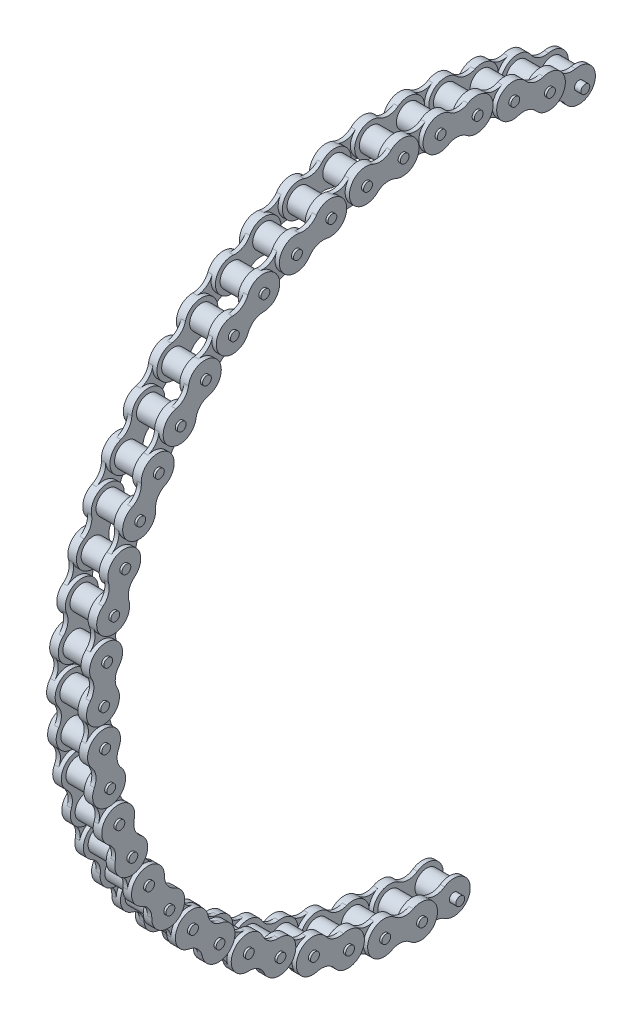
SolidWorks part; units mm, degrees
ref_plane "Plan de face" through (0, 0, 0) normal (0, 0, 1) x (1, 0, 0)
ref_plane "Plan de dessus" through (0, 0, 0) normal (0, 1, 0) x (1, 0, 0)
ref_plane "Plan de droite" through (0, 0, 0) normal (1, 0, 0) x (0, 0, -1)
ref_plane "Plan1" through (5.55, 0, 0) normal (1, 0, 0) x (0, 0, -1)
sketch "Esquisse2" plane through (5.55, 0, 0) normal (1, 0, 0) x (0, 0, -1)
  line L0 (0, 0) -> (77.6529, 191.1858) construction
  line L1 (0, 0) -> (30.7207, 184.099) construction
  line L2 (0, 0) -> (-50.7866, 179.6021) construction
  line L3 (0, 0) -> (0, -186.6446) construction
  line L4 (0, 0) -> (-40.8156, -182.1271) construction
  line L5 (0, 0) -> (-79.6555, -168.7934) construction
  line L6 (0, 0) -> (-183.1826, 35.7818) construction
  line L7 (0, 0) -> (-170.9242, 74.9743) construction
  line L8 (0, 0) -> (-150.3917, 110.5375) construction
  line L9 (0, 0) -> (-122.5792, 140.7499) construction
  line L10 (0, 0) -> (-88.833, 164.149) construction
  line L11 (0, 0) -> (-186.5737, -5.1429) construction
  line L12 (0, 0) -> (-180.9333, -45.8185) construction
  line L13 (0, 0) -> (-166.5344, -84.2763) construction
  line L14 (0, 0) -> (-144.0741, -118.6544) construction
  line L15 (0, 0) -> (-114.6395, -147.2888) construction
  line L16 (0, 0) -> (73.7864, 156.3714) construction
  line L17 (0, 0) -> (56.1365, 163.5395) construction
  line L18 (0, 0) -> (-10.2818, 186.3612) construction
  line L19 (0, 0) -> (40.8156, -182.1271) construction
  line L20 (0, 0) -> (79.6554, -168.7934) construction
  line L21 (0, 0) -> (114.6394, -147.2889) construction
  line L22 (0, 0) -> (144.0739, -118.6546) construction
  line L23 (0, 0) -> (166.5343, -84.2765) construction
  line L24 (0, 0) -> (180.9333, -45.8189) construction
  line L25 (0, 0) -> (186.5737, -5.1432) construction
  line L26 (0, 0) -> (183.1827, 35.7813) construction
  line L27 (0, 0) -> (170.9243, 74.9738) construction
  line L28 (0, 0) -> (150.392, 110.5371) construction
  line L29 (0, 0) -> (122.5797, 140.7495) construction
  line L30 (0, 0) -> (88.8336, 164.1487) construction
  line L31 (0, 0) -> (50.7873, 179.6019) construction
  line L32 (0, 0) -> (10.2826, 186.3611) construction
  line L33 (0, 0) -> (-30.7199, 184.0992) construction
  line L34 (0, 0) -> (-70.2353, 172.9254) construction
  circle A0 centre (0, 0) radius 172.9059 construction
  arc A1 (66.7417, 151.6744) -> (72.0121, 164.6504) centre (73.7864, 156.3714) ccw
  arc A2 (57.9227, 155.2563) -> (63.1932, 168.2324) centre (56.1485, 163.5353) cw
  arc A3 (66.7417, 151.6744) -> (57.9227, 155.2563) centre (59.697, 146.9773) ccw
  arc A4 (63.1932, 168.2324) -> (72.0121, 164.6504) centre (70.2379, 172.9294) ccw
  arc A5 (31.9581, 162.5984) -> (34.2633, 176.413) centre (37.8051, 168.7224) ccw
  arc A6 (31.9581, 162.5984) -> (22.5692, 164.1652) centre (26.111, 156.4745) ccw
  arc A7 (22.5692, 164.1652) -> (24.8745, 177.9797) centre (19.0274, 171.8558) cw
  arc A8 (24.8745, 177.9797) -> (34.2633, 176.413) centre (30.7215, 184.1036) ccw
  arc A9 (-4.3726, 165.6516) -> (-5.1441, 179.6359) centre (-0.0063, 172.9059) ccw
  arc A10 (-4.3726, 165.6516) -> (-13.8768, 165.1272) centre (-8.7389, 158.3973) ccw
  arc A11 (-13.8768, 165.1272) -> (-14.6483, 179.1115) centre (-19.0147, 171.8572) cw
  arc A12 (-14.6483, 179.1115) -> (-5.1441, 179.6359) centre (-10.282, 186.3659) ccw
  arc A13 (-40.4916, 160.686) -> (-44.3025, 174.1631) centre (-37.8173, 168.7196) ccw
  arc A14 (-40.4916, 160.686) -> (-49.6511, 158.096) centre (-43.1659, 152.6525) ccw
  arc A15 (-49.6511, 158.096) -> (-53.462, 171.5731) centre (-56.1363, 163.5395) cw
  arc A16 (-53.462, 171.5731) -> (-44.3025, 174.1631) centre (-50.7878, 179.6067) ccw
  arc A17 (-74.6505, 147.9421) -> (-81.3164, 160.2597) centre (-73.7977, 156.3661) ccw
  arc A18 (-74.6505, 147.9421) -> (-83.0219, 143.4118) centre (-75.5033, 139.5182) ccw
  arc A19 (-83.0219, 143.4118) -> (-89.6878, 155.7293) centre (-90.5406, 147.3053) cw
  arc A20 (-89.6878, 155.7293) -> (-81.3164, 160.2597) centre (-88.835, 164.1532) ccw
  arc A21 (-105.1958, 128.0368) -> (-114.394, 138.5985) centre (-106.2058, 136.4433) ccw
  arc A22 (-105.1958, 128.0368) -> (-112.3739, 121.7854) centre (-104.1858, 119.6302) ccw
  arc A23 (-112.3739, 121.7854) -> (-121.572, 132.3471) centre (-120.562, 123.9405) cw
  arc A24 (-121.572, 132.3471) -> (-114.394, 138.5985) centre (-122.5821, 140.7536) ccw
  arc A25 (-130.6489, 101.9335) -> (-141.934, 110.2281) centre (-133.4728, 109.9157) ccw
  arc A26 (-130.6489, 101.9335) -> (-136.2862, 94.2637) centre (-127.8249, 93.9513) ccw
  arc A27 (-136.2862, 94.2637) -> (-147.5713, 102.5583) centre (-144.7474, 94.5761) cw
  arc A28 (-147.5713, 102.5583) -> (-141.934, 110.2281) centre (-150.3953, 110.5405) ccw
  arc A29 (-149.7776, 70.896) -> (-162.6035, 76.522) centre (-154.2788, 78.0674) ccw
  arc A30 (-149.7776, 70.896) -> (-153.6012, 62.1791) centre (-145.2765, 63.7245) ccw
  arc A31 (-153.6012, 62.1791) -> (-166.4271, 67.805) centre (-161.926, 60.6336) cw
  arc A32 (-166.4271, 67.805) -> (-162.6035, 76.522) centre (-170.9283, 74.9765) ccw
  arc A33 (-161.6561, 36.4266) -> (-175.4018, 39.1116) centre (-167.6165, 42.4401) ccw
  arc A34 (-161.6561, 36.4266) -> (-163.4809, 27.0845) centre (-155.6956, 30.413) ccw
  arc A35 (-163.4809, 27.0845) -> (-177.2267, 29.7695) centre (-171.2662, 23.7559) cw
  arc A36 (-177.2267, 29.7695) -> (-175.4018, 39.1116) centre (-183.1871, 35.7831) ccw
  arc A37 (-165.7092, 0.1938) -> (-179.7094, -0.1921) centre (-172.8404, 4.7584) ccw
  arc A38 (-165.7092, 0.1938) -> (-165.4469, -9.3212) centre (-158.5779, -4.3708) ccw
  arc A39 (-165.4469, -9.3212) -> (-179.4472, -9.7071) centre (-172.3159, -14.2717) cw
  arc A40 (-179.4472, -9.7071) -> (-179.7094, -0.1921) centre (-186.5784, -5.1425) ccw
  arc A41 (-161.7408, -36.0483) -> (-175.3178, -39.4864) centre (-169.6977, -33.1537) ccw
  arc A42 (-161.7408, -36.0483) -> (-159.4042, -45.2757) centre (-153.784, -38.9429) ccw
  arc A43 (-159.4042, -45.2757) -> (-172.9812, -48.7138) centre (-165.0243, -51.6084) cw
  arc A44 (-172.9812, -48.7138) -> (-175.3178, -39.4864) centre (-180.938, -45.8192) ccw
  arc A45 (-149.943, -70.5454) -> (-162.4396, -76.8693) centre (-158.3403, -69.4608) ccw
  arc A46 (-149.943, -70.5454) -> (-145.6451, -79.0385) centre (-141.5458, -71.63) ccw
  arc A47 (-145.6451, -79.0385) -> (-158.1416, -85.3624) centre (-149.7444, -86.447) cw
  arc A48 (-158.1416, -85.3624) -> (-162.4396, -76.8693) centre (-166.5389, -84.2778) ccw
  arc A49 (-130.887, -101.6276) -> (-141.6981, -110.5312) centre (-139.3181, -102.4056) ccw
  arc A50 (-130.887, -101.6276) -> (-124.8358, -108.9753) centre (-122.4558, -100.8496) ccw
  arc A51 (-124.8358, -108.9753) -> (-135.6469, -117.8789) centre (-127.2157, -117.1009) cw
  arc A52 (-135.6469, -117.8789) -> (-141.6981, -110.5312) centre (-144.0781, -118.6569) ccw
  arc A53 (-105.495, -127.7903) -> (-114.0975, -138.8427) centre (-113.552, -130.3932) ccw
  arc A54 (-105.495, -127.7903) -> (-97.9835, -133.6369) centre (-97.438, -125.1874) ccw
  arc A55 (-97.9835, -133.6369) -> (-106.5859, -144.6892) centre (-98.5289, -142.0863) cw
  arc A56 (-106.5859, -144.6892) -> (-114.0975, -138.8427) centre (-114.6429, -147.2921) ccw
  arc A57 (-74.9964, -147.7671) -> (-80.9737, -160.4331) centre (-82.2891, -152.0689) ccw
  arc A58 (-74.9964, -147.7671) -> (-66.3881, -151.8295) centre (-67.7036, -143.4653) ccw
  arc A59 (-66.3881, -151.8295) -> (-72.3654, -164.4955) centre (-65.0726, -160.1937) cw
  arc A60 (-72.3654, -164.4955) -> (-80.9737, -160.4331) centre (-79.6582, -168.7973) ccw
  arc A61 (-40.8674, -160.5909) -> (-43.9302, -174.2574) centre (-47.0429, -166.3834) ccw
  arc A62 (-40.8674, -160.5909) -> (-31.5791, -162.6725) centre (-34.6918, -154.7984) ccw
  arc A63 (-31.5791, -162.6725) -> (-34.6419, -176.339) centre (-28.4664, -170.5465) cw
  arc A64 (-34.6419, -176.339) -> (-43.9302, -174.2574) centre (-40.8175, -182.1315) ccw
  arc A65 (-4.7601, -165.6409) -> (-4.7602, -179.6465) centre (-9.5194, -172.6437) ccw
  arc A66 (-4.7601, -165.6409) -> (4.7586, -165.641) centre (-0.0007, -158.6382) ccw
  arc A67 (4.7586, -165.641) -> (4.7585, -179.6465) centre (9.5179, -172.6438) cw
  arc A68 (4.7585, -179.6465) -> (-4.7602, -179.6465) centre (-0.0009, -186.6493) ccw
  dimension "D1" = 17
extrude "Boss.-Extru.5" add sketch "Esquisse2" along normal blind 2.202
sketch "Esquisse4" plane through (7.752, 0, 0) normal (1, 0, 0) x (0, 0, -1)
  line L0 (0, 0) -> (0, -186.6493) construction
  line L1 (0, 0) -> (70.2379, 172.9294) construction
  line L2 (0, 0) -> (40.8166, -182.1317) construction
  line L3 (0, 0) -> (79.6574, -168.7977) construction
  line L4 (0, 0) -> (114.6422, -147.2926) construction
  line L5 (0, 0) -> (144.0775, -118.6575) construction
  line L6 (0, 0) -> (166.5385, -84.2786) construction
  line L7 (0, 0) -> (180.9378, -45.82) construction
  line L8 (0, 0) -> (186.5784, -5.1434) construction
  line L9 (0, 0) -> (183.1873, 35.7822) construction
  line L10 (0, 0) -> (170.9286, 74.9757) construction
  line L11 (0, 0) -> (150.3958, 110.5398) construction
  line L12 (0, 0) -> (122.5827, 140.7531) construction
  line L13 (0, 0) -> (88.8358, 164.1528) construction
  line L14 (0, 0) -> (50.7886, 179.6064) construction
  line L15 (0, 0) -> (10.2828, 186.3658) construction
  line L16 (0, 0) -> (-30.7207, 184.1038) construction
  line L17 (0, 0) -> (-70.2371, 172.9298) construction
  circle A0 centre (73.7864, 156.3714) radius 6.05
  circle A1 centre (56.1485, 163.5353) radius 6.05
  circle A2 centre (37.8051, 168.7224) radius 6.05
  circle A3 centre (19.0274, 171.8558) radius 6.05
  circle A4 centre (-0.0063, 172.9059) radius 6.05
  circle A5 centre (-19.0147, 171.8572) radius 6.05
  circle A6 centre (-37.8173, 168.7196) radius 6.05
  circle A7 centre (-56.1363, 163.5395) radius 6.05
  circle A8 centre (-73.7977, 156.3661) radius 6.05
  circle A9 centre (-90.5406, 147.3053) radius 6.05
  circle A10 centre (-106.2058, 136.4433) radius 6.05
  circle A11 centre (-120.562, 123.9405) radius 6.05
  circle A12 centre (-133.4728, 109.9157) radius 6.05
  circle A13 centre (-144.7474, 94.5761) radius 6.05
  circle A14 centre (-154.2788, 78.0674) radius 6.05
  circle A15 centre (-161.926, 60.6336) radius 6.05
  circle A16 centre (-167.6165, 42.4401) radius 6.05
  circle A17 centre (-171.2662, 23.7559) radius 6.05
  circle A18 centre (-172.8404, 4.7584) radius 6.05
  circle A19 centre (-172.3159, -14.2717) radius 6.05
  circle A20 centre (-169.6977, -33.1537) radius 6.05
  circle A21 centre (-165.0243, -51.6084) radius 6.05
  circle A22 centre (-158.3403, -69.4608) radius 6.05
  circle A23 centre (-149.7444, -86.447) radius 6.05
  circle A24 centre (-139.3181, -102.4056) radius 6.05
  circle A25 centre (-127.2157, -117.1009) radius 6.05
  circle A26 centre (-113.552, -130.3932) radius 6.05
  circle A27 centre (-98.5289, -142.0863) radius 6.05
  circle A28 centre (-82.2891, -152.0689) radius 6.05
  circle A29 centre (-65.0726, -160.1937) radius 6.05
  circle A30 centre (-47.0429, -166.3834) radius 6.05
  circle A31 centre (-28.4664, -170.5465) radius 6.05
  circle A32 centre (-9.5194, -172.6437) radius 6.05
  circle A33 centre (9.5179, -172.6438) radius 6.05
  arc A34 (4.7585, -179.6465) -> (4.7586, -165.641) centre (9.5179, -172.6438) ccw construction
  dimension "D1" = 17
extrude "Boss.-Extru.6" add sketch "Esquisse4" along normal blind 11.7
sketch "Esquisse5" plane through (19.452, 0, 0) normal (1, 0, 0) x (0, 0, -1)
  arc A0 (66.7417, 151.6744) -> (72.0121, 164.6504) centre (73.7864, 156.3714) ccw
  arc A1 (63.1932, 168.2324) -> (57.9227, 155.2563) centre (56.1485, 163.5353) ccw
  arc A2 (63.1932, 168.2324) -> (72.0121, 164.6504) centre (70.2379, 172.9294) ccw
  arc A3 (66.7417, 151.6744) -> (57.9227, 155.2563) centre (59.697, 146.9773) ccw
  arc A4 (31.9581, 162.5984) -> (34.2633, 176.413) centre (37.8051, 168.7224) ccw
  arc A5 (24.8745, 177.9797) -> (34.2633, 176.413) centre (30.7215, 184.1036) ccw
  arc A6 (31.9581, 162.5984) -> (22.5692, 164.1652) centre (26.111, 156.4745) ccw
  arc A7 (24.8745, 177.9797) -> (22.5692, 164.1652) centre (19.0274, 171.8558) ccw
  arc A8 (-4.3726, 165.6516) -> (-5.1441, 179.6359) centre (-0.0063, 172.9059) ccw
  arc A9 (-14.6483, 179.1115) -> (-5.1441, 179.6359) centre (-10.282, 186.3659) ccw
  arc A10 (-4.3726, 165.6516) -> (-13.8768, 165.1272) centre (-8.7389, 158.3973) ccw
  arc A11 (-14.6483, 179.1115) -> (-13.8768, 165.1272) centre (-19.0147, 171.8572) ccw
  arc A12 (-40.4916, 160.686) -> (-44.3025, 174.1631) centre (-37.8173, 168.7196) ccw
  arc A13 (-53.462, 171.5731) -> (-44.3025, 174.1631) centre (-50.7878, 179.6067) ccw
  arc A14 (-40.4916, 160.686) -> (-49.6511, 158.096) centre (-43.1659, 152.6525) ccw
  arc A15 (-53.462, 171.5731) -> (-49.6511, 158.096) centre (-56.1363, 163.5395) ccw
  arc A16 (-74.6505, 147.9421) -> (-81.3164, 160.2597) centre (-73.7977, 156.3661) ccw
  arc A17 (-89.6878, 155.7293) -> (-81.3164, 160.2597) centre (-88.835, 164.1532) ccw
  arc A18 (-74.6505, 147.9421) -> (-83.0219, 143.4118) centre (-75.5033, 139.5182) ccw
  arc A19 (-89.6878, 155.7293) -> (-83.0219, 143.4118) centre (-90.5406, 147.3053) ccw
  arc A20 (-105.1958, 128.0368) -> (-114.394, 138.5985) centre (-106.2058, 136.4433) ccw
  arc A21 (-121.572, 132.3471) -> (-114.394, 138.5985) centre (-122.5821, 140.7536) ccw
  arc A22 (-105.1958, 128.0368) -> (-112.3739, 121.7854) centre (-104.1858, 119.6302) ccw
  arc A23 (-121.572, 132.3471) -> (-112.3739, 121.7854) centre (-120.562, 123.9405) ccw
  arc A24 (-130.6489, 101.9335) -> (-141.934, 110.2281) centre (-133.4728, 109.9157) ccw
  arc A25 (-147.5713, 102.5583) -> (-141.934, 110.2281) centre (-150.3953, 110.5405) ccw
  arc A26 (-130.6489, 101.9335) -> (-136.2862, 94.2637) centre (-127.8249, 93.9513) ccw
  arc A27 (-147.5713, 102.5583) -> (-136.2862, 94.2637) centre (-144.7474, 94.5761) ccw
  arc A28 (-149.7776, 70.896) -> (-162.6035, 76.522) centre (-154.2788, 78.0674) ccw
  arc A29 (-166.4271, 67.805) -> (-162.6035, 76.522) centre (-170.9283, 74.9765) ccw
  arc A30 (-149.7776, 70.896) -> (-153.6012, 62.1791) centre (-145.2765, 63.7245) ccw
  arc A31 (-166.4271, 67.805) -> (-153.6012, 62.1791) centre (-161.926, 60.6336) ccw
  arc A32 (-161.6561, 36.4266) -> (-175.4018, 39.1116) centre (-167.6165, 42.4401) ccw
  arc A33 (-177.2267, 29.7695) -> (-175.4018, 39.1116) centre (-183.1871, 35.7831) ccw
  arc A34 (-161.6561, 36.4266) -> (-163.4809, 27.0845) centre (-155.6956, 30.413) ccw
  arc A35 (-177.2267, 29.7695) -> (-163.4809, 27.0845) centre (-171.2662, 23.7559) ccw
  arc A36 (-165.7092, 0.1938) -> (-179.7094, -0.1921) centre (-172.8404, 4.7584) ccw
  arc A37 (-179.4472, -9.7071) -> (-179.7094, -0.1921) centre (-186.5784, -5.1425) ccw
  arc A38 (-165.7092, 0.1938) -> (-165.4469, -9.3212) centre (-158.5779, -4.3708) ccw
  arc A39 (-179.4472, -9.7071) -> (-165.4469, -9.3212) centre (-172.3159, -14.2717) ccw
  arc A40 (-161.7408, -36.0483) -> (-175.3178, -39.4864) centre (-169.6977, -33.1537) ccw
  arc A41 (-172.9812, -48.7138) -> (-175.3178, -39.4864) centre (-180.938, -45.8192) ccw
  arc A42 (-161.7408, -36.0483) -> (-159.4042, -45.2757) centre (-153.784, -38.9429) ccw
  arc A43 (-172.9812, -48.7138) -> (-159.4042, -45.2757) centre (-165.0243, -51.6084) ccw
  arc A44 (-149.943, -70.5454) -> (-162.4396, -76.8693) centre (-158.3403, -69.4608) ccw
  arc A45 (-158.1416, -85.3624) -> (-162.4396, -76.8693) centre (-166.5389, -84.2778) ccw
  arc A46 (-149.943, -70.5454) -> (-145.6451, -79.0385) centre (-141.5458, -71.63) ccw
  arc A47 (-158.1416, -85.3624) -> (-145.6451, -79.0385) centre (-149.7444, -86.447) ccw
  arc A48 (-130.887, -101.6276) -> (-141.6981, -110.5312) centre (-139.3181, -102.4056) ccw
  arc A49 (-135.6469, -117.8789) -> (-141.6981, -110.5312) centre (-144.0781, -118.6569) ccw
  arc A50 (-130.887, -101.6276) -> (-124.8358, -108.9753) centre (-122.4558, -100.8496) ccw
  arc A51 (-135.6469, -117.8789) -> (-124.8358, -108.9753) centre (-127.2157, -117.1009) ccw
  arc A52 (-105.495, -127.7903) -> (-114.0975, -138.8427) centre (-113.552, -130.3932) ccw
  arc A53 (-106.5859, -144.6892) -> (-114.0975, -138.8427) centre (-114.6429, -147.2921) ccw
  arc A54 (-105.495, -127.7903) -> (-97.9835, -133.6369) centre (-97.438, -125.1874) ccw
  arc A55 (-106.5859, -144.6892) -> (-97.9835, -133.6369) centre (-98.5289, -142.0863) ccw
  arc A56 (-74.9964, -147.7671) -> (-80.9737, -160.4331) centre (-82.2891, -152.0689) ccw
  arc A57 (-72.3654, -164.4955) -> (-80.9737, -160.4331) centre (-79.6582, -168.7973) ccw
  arc A58 (-74.9964, -147.7671) -> (-66.3881, -151.8295) centre (-67.7036, -143.4653) ccw
  arc A59 (-72.3654, -164.4955) -> (-66.3881, -151.8295) centre (-65.0726, -160.1937) ccw
  arc A60 (-40.8674, -160.5909) -> (-43.9302, -174.2574) centre (-47.0429, -166.3834) ccw
  arc A61 (-34.6419, -176.339) -> (-43.9302, -174.2574) centre (-40.8175, -182.1315) ccw
  arc A62 (-40.8674, -160.5909) -> (-31.5791, -162.6725) centre (-34.6918, -154.7984) ccw
  arc A63 (-34.6419, -176.339) -> (-31.5791, -162.6725) centre (-28.4664, -170.5465) ccw
  arc A64 (-4.7601, -165.6409) -> (-4.7602, -179.6465) centre (-9.5194, -172.6437) ccw
  arc A65 (4.7585, -179.6465) -> (-4.7602, -179.6465) centre (-0.0009, -186.6493) ccw
  arc A66 (-4.7601, -165.6409) -> (4.7586, -165.641) centre (-0.0007, -158.6382) ccw
  arc A67 (4.7585, -179.6465) -> (4.7586, -165.641) centre (9.5179, -172.6438) ccw
  circle A68 centre (9.5179, -172.6438) radius 6.05 construction
extrude "Boss.-Extru.7" add sketch "Esquisse5" along normal blind 2.202
sketch "Esquisse6" plane through (21.654, 0, 0) normal (1, 0, 0) x (0, 0, -1)
  line L0 (0, 0) -> (70.2379, 172.9294) construction
  line L1 (0, 0) -> (-0.0009, -186.6493) construction
  circle A0 centre (73.7864, 156.3714) radius 2.269
  circle A1 centre (56.1485, 163.5353) radius 2.269
  circle A2 centre (19.0274, 171.8558) radius 2.269
  circle A3 centre (37.8051, 168.7224) radius 2.269
  circle A4 centre (-19.0147, 171.8572) radius 2.269
  circle A5 centre (-0.0063, 172.9059) radius 2.269
  circle A6 centre (-56.1363, 163.5395) radius 2.269
  circle A7 centre (-37.8173, 168.7196) radius 2.269
  circle A8 centre (-90.5406, 147.3053) radius 2.269
  circle A9 centre (-73.7977, 156.3661) radius 2.269
  circle A10 centre (-120.562, 123.9405) radius 2.269
  circle A11 centre (-106.2058, 136.4433) radius 2.269
  circle A12 centre (-144.7474, 94.5761) radius 2.269
  circle A13 centre (-133.4728, 109.9157) radius 2.269
  circle A14 centre (-161.926, 60.6336) radius 2.269
  circle A15 centre (-154.2788, 78.0674) radius 2.269
  circle A16 centre (-171.2662, 23.7559) radius 2.269
  circle A17 centre (-167.6165, 42.4401) radius 2.269
  circle A18 centre (-172.3159, -14.2717) radius 2.269
  circle A19 centre (-172.8404, 4.7584) radius 2.269
  circle A20 centre (-165.0243, -51.6084) radius 2.269
  circle A21 centre (-169.6977, -33.1537) radius 2.269
  circle A22 centre (-149.7444, -86.447) radius 2.269
  circle A23 centre (-158.3403, -69.4608) radius 2.269
  circle A24 centre (-127.2157, -117.1009) radius 2.269
  circle A25 centre (-139.3181, -102.4056) radius 2.269
  circle A26 centre (-98.5289, -142.0863) radius 2.269
  circle A27 centre (-113.552, -130.3932) radius 2.269
  circle A28 centre (-65.0726, -160.1937) radius 2.269
  circle A29 centre (-82.2891, -152.0689) radius 2.269
  circle A30 centre (-28.4664, -170.5465) radius 2.269
  circle A31 centre (-47.0429, -166.3834) radius 2.269
  circle A32 centre (9.5179, -172.6438) radius 2.269
  circle A33 centre (-9.5194, -172.6437) radius 2.269
  arc A34 (4.7585, -179.6465) -> (4.7586, -165.641) centre (9.5179, -172.6438) ccw construction
  dimension "D1" = 17
extrude "Boss.-Extru.8" add sketch "Esquisse6" along normal blind 3.303 and the other way blind 19.407
sketch "Esquisse7" plane through (21.654, 0, 0) normal (1, 0, 0) x (0, 0, -1)
  arc A0 (49.6583, 158.0977) -> (53.4669, 171.5665) centre (56.1485, 163.5353) ccw
  arc A1 (44.2953, 174.16) -> (40.4866, 160.6912) centre (37.8051, 168.7224) ccw
  arc A2 (44.2953, 174.16) -> (53.4669, 171.5665) centre (50.7854, 179.5977) ccw
  arc A3 (49.6583, 158.0977) -> (40.4866, 160.6912) centre (43.1682, 152.66) ccw
  arc A4 (63.1932, 168.2324) -> (57.9227, 155.2563) centre (56.1485, 163.5353) ccw construction
  arc A5 (31.9581, 162.5984) -> (34.2633, 176.413) centre (37.8051, 168.7224) ccw construction
  arc A6 (5.1377, 179.6312) -> (4.3666, 165.6555) centre (-0.0063, 172.9059) ccw
  arc A7 (13.8835, 165.1305) -> (14.6545, 179.1062) centre (19.0274, 171.8558) ccw
  arc A8 (5.1377, 179.6312) -> (14.6545, 179.1062) centre (10.2817, 186.3565) ccw
  arc A9 (13.8835, 165.1305) -> (4.3666, 165.6555) centre (8.7395, 158.4052) ccw
  arc A10 (-34.2686, 176.407) -> (-31.9647, 162.601) centre (-37.8173, 168.7196) ccw
  arc A11 (-22.5634, 164.1698) -> (-24.8672, 177.9758) centre (-19.0147, 171.8572) ccw
  arc A12 (-34.2686, 176.407) -> (-24.8672, 177.9758) centre (-30.7198, 184.0945) ccw
  arc A13 (-22.5634, 164.1698) -> (-31.9647, 162.601) centre (-26.1122, 156.4824) ccw
  arc A14 (-72.016, 164.6435) -> (-66.7488, 151.6754) centre (-73.7977, 156.3661) ccw
  arc A15 (-57.9181, 155.2621) -> (-63.1853, 168.2302) centre (-56.1363, 163.5395) ccw
  arc A16 (-72.016, 164.6435) -> (-63.1853, 168.2302) centre (-70.2342, 172.9209) ccw
  arc A17 (-57.9181, 155.2621) -> (-66.7488, 151.6754) centre (-59.6999, 146.9847) ccw
  arc A18 (-106.2773, 144.91) -> (-98.3017, 133.4076) centre (-106.2058, 136.4433) ccw
  arc A19 (-90.4691, 138.8386) -> (-98.4447, 150.341) centre (-90.5406, 147.3053) ccw
  arc A20 (-106.2773, 144.91) -> (-98.4447, 150.341) centre (-106.3488, 153.3767) ccw
  arc A21 (-90.4691, 138.8386) -> (-98.3017, 133.4076) centre (-90.3976, 130.3719) ccw
  arc A22 (-135.394, 118.1619) -> (-125.0962, 108.682) centre (-133.4728, 109.9157) ccw
  arc A23 (-118.6408, 115.6944) -> (-128.9386, 125.1743) centre (-120.562, 123.9405) ccw
  arc A24 (-135.394, 118.1619) -> (-128.9386, 125.1743) centre (-137.3153, 126.408) ccw
  arc A25 (-118.6408, 115.6944) -> (-125.0962, 108.682) centre (-116.7195, 107.4482) ccw
  arc A26 (-157.9568, 85.6939) -> (-145.8351, 78.6954) centre (-154.2788, 78.0674) ccw
  arc A27 (-141.0694, 86.9497) -> (-153.1911, 93.9482) centre (-144.7474, 94.5761) ccw
  arc A28 (-157.9568, 85.6939) -> (-153.1911, 93.9482) centre (-161.6348, 93.3203) ccw
  arc A29 (-141.0694, 86.9497) -> (-145.8351, 78.6954) centre (-137.3914, 79.3233) ccw
  arc A30 (-172.8732, 49.0776) -> (-159.5145, 44.8993) centre (-167.6165, 42.4401) ccw
  arc A31 (-156.6692, 53.9961) -> (-170.028, 58.1744) centre (-161.926, 60.6336) ccw
  arc A32 (-172.8732, 49.0776) -> (-170.028, 58.1744) centre (-178.13, 55.7152) ccw
  arc A33 (-156.6692, 53.9961) -> (-159.5145, 44.8993) centre (-151.4125, 47.3585) ccw
  arc A34 (-179.4214, 10.0857) -> (-165.4723, 8.9298) centre (-172.8404, 4.7584) ccw
  arc A35 (-164.6852, 18.4286) -> (-178.6343, 19.5845) centre (-171.2662, 23.7559) ccw
  arc A36 (-179.4214, 10.0857) -> (-178.6343, 19.5845) centre (-186.0025, 15.4131) ccw
  arc A37 (-164.6852, 18.4286) -> (-165.4723, 8.9298) centre (-158.1042, 13.1013) ccw
  arc A38 (-177.2844, -29.3944) -> (-163.4201, -27.4719) centre (-169.6977, -33.1537) ccw
  arc A39 (-164.7292, -18.0309) -> (-178.5935, -19.9534) centre (-172.3159, -14.2717) ccw
  arc A40 (-177.2844, -29.3944) -> (-178.5935, -19.9534) centre (-184.8711, -25.6352) ccw
  arc A41 (-164.7292, -18.0309) -> (-163.4201, -27.4719) centre (-157.1425, -21.7902) ccw
  arc A42 (-166.5655, -67.4516) -> (-153.4572, -62.5438) centre (-158.3403, -69.4608) ccw
  arc A43 (-156.7992, -53.6176) -> (-169.9075, -58.5254) centre (-165.0243, -51.6084) ccw
  arc A44 (-166.5655, -67.4516) -> (-169.9075, -58.5254) centre (-174.7906, -65.4425) ccw
  arc A45 (-156.7992, -53.6176) -> (-153.4572, -62.5438) centre (-148.574, -55.6268) ccw
  arc A46 (-147.7836, -102.2437) -> (-136.0658, -94.5882) centre (-139.3181, -102.4056) ccw
  arc A47 (-141.2789, -86.6089) -> (-152.9967, -94.2644) centre (-149.7444, -86.447) ccw
  arc A48 (-147.7836, -102.2437) -> (-152.9967, -94.2644) centre (-156.2491, -102.0819) ccw
  arc A49 (-141.2789, -86.6089) -> (-136.0658, -94.5882) centre (-132.8135, -86.7707) ccw
  arc A50 (-121.848, -132.0865) -> (-112.0879, -122.0538) centre (-113.552, -130.3932) ccw
  arc A51 (-118.9198, -115.4076) -> (-128.6798, -125.4403) centre (-127.2157, -117.1009) ccw
  arc A52 (-121.848, -132.0865) -> (-128.6798, -125.4403) centre (-130.1439, -133.7798) ccw
  arc A53 (-118.9198, -115.4076) -> (-112.0879, -122.0538) centre (-110.6238, -113.7143) ccw
  arc A54 (-90.014, -155.5354) -> (-82.6842, -143.6111) centre (-82.2891, -152.0689) ccw
  arc A55 (-90.8041, -138.6198) -> (-98.1339, -150.544) centre (-98.5289, -142.0863) ccw
  arc A56 (-90.014, -155.5354) -> (-98.1339, -150.544) centre (-97.7389, -159.0018) ccw
  arc A57 (-90.8041, -138.6198) -> (-82.6842, -143.6111) centre (-83.0792, -135.1534) ccw
  arc A58 (-53.8228, -171.4552) -> (-49.2779, -158.2167) centre (-47.0429, -166.3834) ccw
  arc A59 (-58.2928, -155.1218) -> (-62.8376, -168.3603) centre (-65.0726, -160.1937) ccw
  arc A60 (-53.8228, -171.4552) -> (-62.8376, -168.3603) centre (-60.6026, -176.527) ccw
  arc A61 (-58.2928, -155.1218) -> (-49.2779, -158.2167) centre (-51.5129, -150.05) ccw
  arc A62 (-15.0261, -179.0754) -> (-13.4863, -165.1634) centre (-9.5194, -172.6437) ccw
  arc A63 (-22.9597, -164.1148) -> (-24.4996, -178.0268) centre (-28.4664, -170.5465) ccw
  arc A64 (-15.0261, -179.0754) -> (-24.4996, -178.0268) centre (-20.5328, -185.5071) ccw
  arc A65 (-22.9597, -164.1148) -> (-13.4863, -165.1634) centre (-17.4531, -157.6831) ccw
  arc A69 (24.8745, 177.9797) -> (22.5692, 164.1652) centre (19.0274, 171.8558) ccw construction
  dimension "D1" = 16
extrude "Boss.-Extru.9" add sketch "Esquisse7" along normal blind 2.202
sketch "Esquisse8" plane through (5.55, 0, 0) normal (-1, 0, 0) x (0, 0, 1)
  arc A0 (-53.4669, 171.5665) -> (-49.6583, 158.0977) centre (-56.1485, 163.5353) ccw
  arc A1 (-40.4866, 160.6912) -> (-44.2953, 174.16) centre (-37.8051, 168.7224) ccw
  arc A2 (-53.4669, 171.5665) -> (-44.2953, 174.16) centre (-50.7854, 179.5977) ccw
  arc A3 (-40.4866, 160.6912) -> (-49.6583, 158.0977) centre (-43.1682, 152.66) ccw
  arc A4 (-14.6545, 179.1062) -> (-13.8835, 165.1305) centre (-19.0274, 171.8558) ccw
  arc A5 (-4.3666, 165.6555) -> (-5.1377, 179.6312) centre (0.0063, 172.9059) ccw
  arc A6 (-4.3666, 165.6555) -> (-13.8835, 165.1305) centre (-8.7395, 158.4052) ccw
  arc A7 (-14.6545, 179.1062) -> (-5.1377, 179.6312) centre (-10.2817, 186.3565) ccw
  arc A8 (24.8672, 177.9758) -> (22.5634, 164.1698) centre (19.0147, 171.8572) ccw
  arc A9 (31.9647, 162.601) -> (34.2686, 176.407) centre (37.8173, 168.7196) ccw
  arc A10 (31.9647, 162.601) -> (22.5634, 164.1698) centre (26.1122, 156.4824) ccw
  arc A11 (24.8672, 177.9758) -> (34.2686, 176.407) centre (30.7198, 184.0945) ccw
  arc A12 (63.1853, 168.2302) -> (57.9181, 155.2621) centre (56.1363, 163.5395) ccw
  arc A13 (66.7488, 151.6754) -> (72.016, 164.6435) centre (73.7977, 156.3661) ccw
  arc A14 (66.7488, 151.6754) -> (57.9181, 155.2621) centre (59.6999, 146.9847) ccw
  arc A15 (63.1853, 168.2302) -> (72.016, 164.6435) centre (70.2342, 172.9209) ccw
  arc A16 (98.4447, 150.341) -> (90.4691, 138.8386) centre (90.5406, 147.3053) ccw
  arc A17 (98.3017, 133.4076) -> (106.2773, 144.91) centre (106.2058, 136.4433) ccw
  arc A18 (98.3017, 133.4076) -> (90.4691, 138.8386) centre (90.3976, 130.3719) ccw
  arc A19 (98.4447, 150.341) -> (106.2773, 144.91) centre (106.3488, 153.3767) ccw
  arc A20 (128.9386, 125.1743) -> (118.6408, 115.6944) centre (120.562, 123.9405) ccw
  arc A21 (125.0962, 108.682) -> (135.394, 118.1619) centre (133.4728, 109.9157) ccw
  arc A22 (125.0962, 108.682) -> (118.6408, 115.6944) centre (116.7195, 107.4482) ccw
  arc A23 (128.9386, 125.1743) -> (135.394, 118.1619) centre (137.3153, 126.408) ccw
  arc A24 (153.1911, 93.9482) -> (141.0694, 86.9497) centre (144.7474, 94.5761) ccw
  arc A25 (145.8351, 78.6954) -> (157.9568, 85.6939) centre (154.2788, 78.0674) ccw
  arc A26 (145.8351, 78.6954) -> (141.0694, 86.9497) centre (137.3914, 79.3233) ccw
  arc A27 (153.1911, 93.9482) -> (157.9568, 85.6939) centre (161.6348, 93.3203) ccw
  arc A28 (170.028, 58.1744) -> (156.6692, 53.9961) centre (161.926, 60.6336) ccw
  arc A29 (159.5145, 44.8993) -> (172.8732, 49.0776) centre (167.6165, 42.4401) ccw
  arc A30 (159.5145, 44.8993) -> (156.6692, 53.9961) centre (151.4125, 47.3585) ccw
  arc A31 (170.028, 58.1744) -> (172.8732, 49.0776) centre (178.13, 55.7152) ccw
  arc A32 (178.6343, 19.5845) -> (164.6852, 18.4286) centre (171.2662, 23.7559) ccw
  arc A33 (165.4723, 8.9298) -> (179.4214, 10.0857) centre (172.8404, 4.7584) ccw
  arc A34 (165.4723, 8.9298) -> (164.6852, 18.4286) centre (158.1042, 13.1013) ccw
  arc A35 (178.6343, 19.5845) -> (179.4214, 10.0857) centre (186.0025, 15.4131) ccw
  arc A36 (178.5935, -19.9534) -> (164.7292, -18.0309) centre (172.3159, -14.2717) ccw
  arc A37 (163.4201, -27.4719) -> (177.2844, -29.3944) centre (169.6977, -33.1537) ccw
  arc A38 (163.4201, -27.4719) -> (164.7292, -18.0309) centre (157.1425, -21.7902) ccw
  arc A39 (178.5935, -19.9534) -> (177.2844, -29.3944) centre (184.8711, -25.6352) ccw
  arc A40 (169.9075, -58.5254) -> (156.7992, -53.6176) centre (165.0243, -51.6084) ccw
  arc A41 (153.4572, -62.5438) -> (166.5655, -67.4516) centre (158.3403, -69.4608) ccw
  arc A42 (153.4572, -62.5438) -> (156.7992, -53.6176) centre (148.574, -55.6268) ccw
  arc A43 (169.9075, -58.5254) -> (166.5655, -67.4516) centre (174.7906, -65.4425) ccw
  arc A44 (152.9967, -94.2644) -> (141.2789, -86.6089) centre (149.7444, -86.447) ccw
  arc A45 (136.0658, -94.5882) -> (147.7836, -102.2437) centre (139.3181, -102.4056) ccw
  arc A46 (136.0658, -94.5882) -> (141.2789, -86.6089) centre (132.8135, -86.7707) ccw
  arc A47 (152.9967, -94.2644) -> (147.7836, -102.2437) centre (156.2491, -102.0819) ccw
  arc A48 (128.6798, -125.4403) -> (118.9198, -115.4076) centre (127.2157, -117.1009) ccw
  arc A49 (112.0879, -122.0538) -> (121.848, -132.0865) centre (113.552, -130.3932) ccw
  arc A50 (112.0879, -122.0538) -> (118.9198, -115.4076) centre (110.6238, -113.7143) ccw
  arc A51 (128.6798, -125.4403) -> (121.848, -132.0865) centre (130.1439, -133.7798) ccw
  arc A52 (98.1339, -150.544) -> (90.8041, -138.6198) centre (98.5289, -142.0863) ccw
  arc A53 (82.6842, -143.6111) -> (90.014, -155.5354) centre (82.2891, -152.0689) ccw
  arc A54 (82.6842, -143.6111) -> (90.8041, -138.6198) centre (83.0792, -135.1534) ccw
  arc A55 (98.1339, -150.544) -> (90.014, -155.5354) centre (97.7389, -159.0018) ccw
  arc A56 (62.8376, -168.3603) -> (58.2928, -155.1218) centre (65.0726, -160.1937) ccw
  arc A57 (49.2779, -158.2167) -> (53.8228, -171.4552) centre (47.0429, -166.3834) ccw
  arc A58 (49.2779, -158.2167) -> (58.2928, -155.1218) centre (51.5129, -150.05) ccw
  arc A59 (62.8376, -168.3603) -> (53.8228, -171.4552) centre (60.6026, -176.527) ccw
  arc A60 (-22.5692, 164.1652) -> (-24.8745, 177.9797) centre (-19.0274, 171.8558) ccw construction
  arc A64 (24.4996, -178.0268) -> (22.9597, -164.1148) centre (28.4664, -170.5465) ccw
  arc A65 (13.4863, -165.1634) -> (15.0261, -179.0754) centre (9.5194, -172.6437) ccw
  arc A66 (13.4863, -165.1634) -> (22.9597, -164.1148) centre (17.4531, -157.6831) ccw
  arc A67 (24.4996, -178.0268) -> (15.0261, -179.0754) centre (20.5328, -185.5071) ccw
  dimension "D1" = 16
extrude "Boss.-Extru.10" add sketch "Esquisse8" along normal blind 2.202
sketch "Esquisse9" plane through (5.55, 0, 0) normal (-1, 0, 0) x (0, 0, 1)
  arc A0 (24.4996, -178.0268) -> (22.9597, -164.1148) centre (28.4664, -170.5465) ccw
  arc A1 (13.4863, -165.1634) -> (15.0261, -179.0754) centre (9.5194, -172.6437) ccw
  arc A2 (13.4863, -165.1634) -> (22.9597, -164.1148) centre (17.4531, -157.6831) ccw
  arc A3 (24.4996, -178.0268) -> (15.0261, -179.0754) centre (20.5328, -185.5071) ccw
extrude "Boss.-Extru.11" add sketch "Esquisse9" along normal blind 2.202
